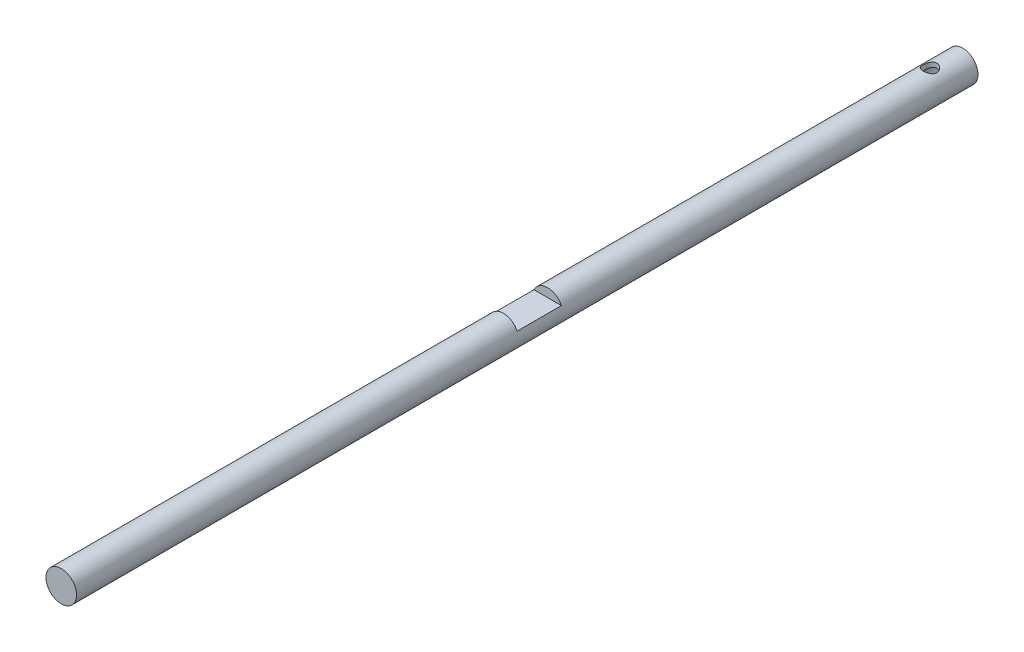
SolidWorks part; units mm, degrees
ref_plane "Front Plane" through (0, 0, 0) normal (0, 0, 1) x (1, 0, 0)
ref_plane "Top Plane" through (0, 0, 0) normal (0, 1, 0) x (1, 0, 0)
ref_plane "Right Plane" through (0, 0, 0) normal (1, 0, 0) x (0, 0, -1)
sketch "Sketch1" plane through (0, 0, 0) normal (0, 0, 1) x (1, 0, 0)
  circle A0 centre (0, 0) radius 4.445
  dimension "D1" = 8.89
extrude "Boss-Extrude1" add sketch "Sketch1" against normal up to surface (262.049 mm away)
sketch "Sketch2" plane through (0, 0, -262.049) normal (0, 0, -1) x (-1, 0, 0)
  circle A0 centre (0, 0) radius 3.175
  dimension "D1" = 6.35
extrude "Cut-Extrude1" cut sketch "Sketch2" against normal blind 25.4
sketch "Sketch3" plane through (0, 21, 0) normal (0, 1, 0) x (0, 0, 1)
  line L1 (-262.049, 4.445) -> (-262.049, -4.445) construction
  line L2 (-262.049, 4.445) -> (-262.049, -4.445)
  line L3 (-262.049, 0) -> (-241.3374, 0) construction
  line L4 (-141.399, -4.445) -> (-128.524, -4.445)
  line L5 (-141.399, -4.445) -> (-141.399, 4.445)
  line L6 (-128.524, -4.445) -> (-128.524, 4.445)
  line L7 (-141.399, 4.445) -> (-128.524, 4.445)
  line L8 (-141.399, -4.445) -> (-128.524, 4.445) construction
  line L9 (-128.524, -4.445) -> (-141.399, 4.445) construction
  line L10 (-262.049, -4.445) -> (0, -4.445) construction
  line L11 (0, 4.445) -> (-262.049, 4.445) construction
  line L12 (-7.874, 40.2331) -> (-7.874, -28.5) construction
  circle A0 centre (-252.524, 0) radius 2
  point P8 (-134.9615, 0)
  dimension "D1" = 4
  dimension "D2" = 9.525
  dimension "D3" = 120.65
  dimension "D4" = 120.65
extrude "Cut-Extrude2" cut sketch "Sketch3" against normal blind 19.05 contours A0 L3 | L3 A0 | L4 L5 L7 L6
